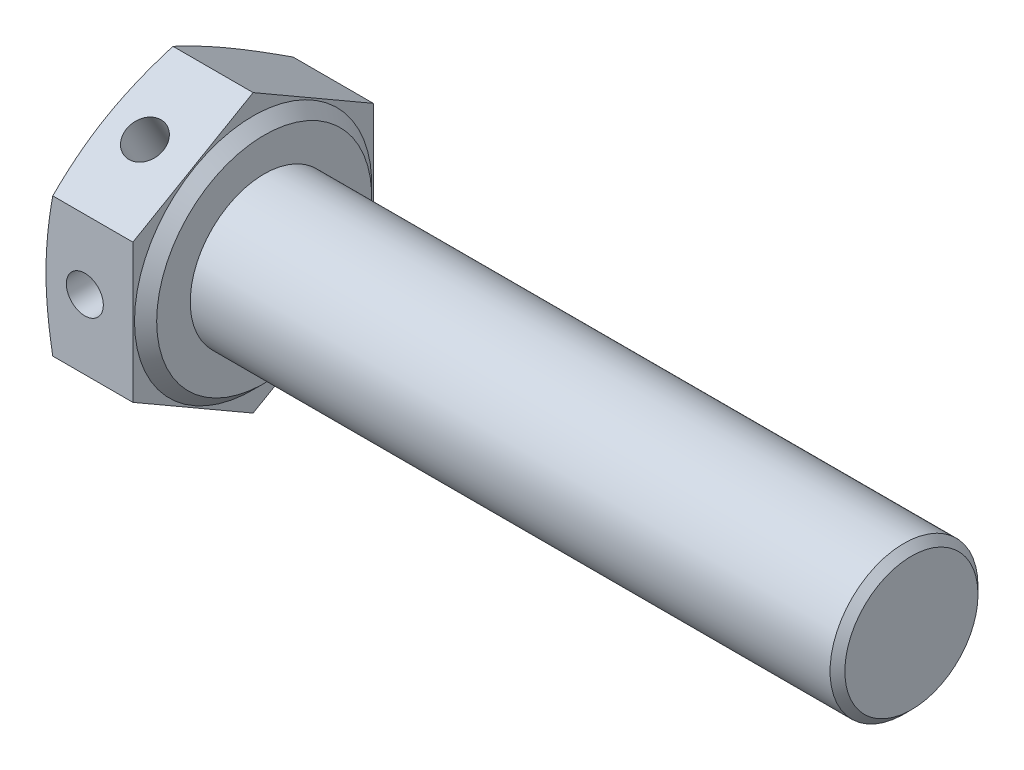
SolidWorks part; units mm, degrees
ref_plane "Front" through (0, 0, 0) normal (0, 0, 1) x (1, 0, 0)
ref_plane "Top" through (0, 0, 0) normal (0, 1, 0) x (1, 0, 0)
ref_plane "Right" through (0, 0, 0) normal (1, 0, 0) x (0, 0, -1)
other "Configuration Table"
sketch "Sketch2" plane through (0, 0, 0) normal (1, 0, 0) x (0, 0, -1)
  line L1 (0, -7.5056) -> (6.5, -3.7528)
  line L2 (6.5, -3.7528) -> (6.5, 3.7528)
  line L3 (6.5, 3.7528) -> (0, 7.5056)
  line L4 (0, 7.5056) -> (-6.5, 3.7528)
  line L5 (-6.5, 3.7528) -> (-6.5, -3.7528)
  line L6 (-6.5, -3.7528) -> (0, -7.5056)
  circle A0 centre (0, 0) radius 6.5 construction
extrude "BaseHead" add sketch "Sketch2" along normal blind 5.3
sketch "Sketch3" plane through (0, 0, 0) normal (0, 0, 1) x (1, 0, 0)
  line L0 (5.3, 7.5056) -> (5.3, 5.815)
  line L2 (5.3, 5.815) -> (4.7, 6.415)
  line L3 (4.7, 6.415) -> (4.7, 7.5056)
  line L5 (4.7, 7.5056) -> (5.3, 7.5056)
  line L6 (-0.9571, 0) -> (7.6478, 0) construction
  line L7 (5.3, 7.5056) -> (0, 7.5056) construction
  dimension "D1" = 45
  dimension "c" = 0.6
  dimension "dw" = 11.63
revolve "BearingFace" cut sketch "Sketch3" angle 360 about L6
sketch "Sketch4" plane through (0, 0, 0) normal (0, 0, 1) x (1, 0, 0)
  line L0 (-0.4935, 0) -> (3.5626, 0) construction
  line L2 (0, 7.5056) -> (0.366, 7.5056)
  line L4 (0.366, 7.5056) -> (0, 6.5)
  line L6 (0, 6.5) -> (0, 7.5056)
  line L7 (4.7, 7.5056) -> (0, 7.5056) construction
revolve "HeadChamfer" cut sketch "Sketch4" angle 360 about L0
ref_plane "Plane1" through (23.3, 0, 0) normal (1, 0, 0) x (0, 0, -1)
sketch "Sketch5" plane through (5.3, 0, 0) normal (1, 0, 0) x (0, 0, -1)
  circle A0 centre (0, 0) radius 4
extrude "BaseBody" add sketch "Sketch5" along normal blind 35
chamfer "Chamfer1" distance 0.4 angle 45 1 edges at (40.3, 0, -4)
sketch "Sketch6" plane through (0, 0, 0) normal (0, 0, 1) x (1, 0, 0)
  line L2 (4.7, 3.7528) -> (4.7, -3.7528) construction
  line L3 (39.9, 0) -> (5.3, 0) construction
  circle A0 centre (2.1, 0) radius 1
  dimension "d1" = 2
  dimension "h" = 2.6
extrude "Hole" cut sketch "Sketch6" against normal through all and the other way through all
pattern_circular "CirPattern1" count 2 over 60 about axis through (40.3, 0, 0) along (-1, 0, 0) of "Hole"
fillet "HeadFillet" [suppressed] radius 0.4
sketch "Sketch7" plane through (0, 0, 0) normal (0, 0, 1) x (1, 0, 0)
  line L0 (39.359, 4.2) -> (39.899, 4.2)
  line L1 (39.899, 4.2) -> (39.899, 4)
  line L2 (39.899, 4) -> (39.629, 3.5323)
  line L3 (39.359, 4) -> (39.629, 3.5323)
  line L4 (39.359, 4.2) -> (39.359, 4)
  line L5 (41.2163, 0) -> (0, 0) construction
  line L6 (39.359, 4) -> (39.899, 4) construction
  line L7 (39.629, 4) -> (39.629, 3.5323) construction
  line L8 (39.9, 4) -> (5.3, 4) construction
  point P5 (39.629, 4.2)
revolve "Cut-Revolve10" [suppressed] cut sketch "Sketch7" angle 360 about L5
pattern_linear "LPattern10" [suppressed] count 26 spacing 0.648
equation "\"D2@Sketch4\" = \"s@Sketch2\""
equation "\"b@ThreadCosmetic1\" = \"l@BaseBody\" - \"lg@Plane1\""
equation "\"D1@Chamfer1\" = 0.05 * \"d@Sketch5\""
equation "\"D3@LPattern10\" = \"D2@Sketch7\" * 1.2"
equation "\"D1@LPattern10\" = \"b@ThreadCosmetic1\" / \"D3@LPattern10\""
